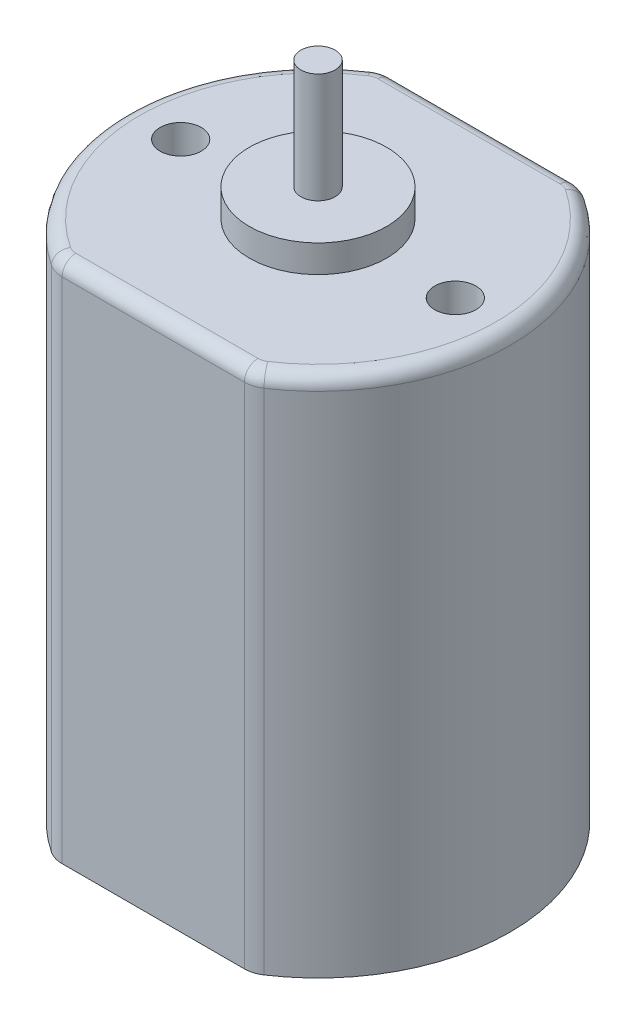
SolidWorks part; units mm, degrees
ref_plane "Face" through (0, 0, 0) normal (0, 0, 1) x (1, 0, 0)
ref_plane "Dessus" through (0, 0, 0) normal (0, 1, 0) x (1, 0, 0)
ref_plane "Droite" through (0, 0, 0) normal (1, 0, 0) x (0, 0, -1)
sketch "Esquisse1" plane through (0, 0, 0) normal (0, 1, 0) x (1, 0, 0)
  line L0 (-3.3166, -6) -> (3.3166, -6)
  line L1 (10.1485, 0) -> (-10.128, 0) construction
  line L2 (-3.3166, 6) -> (3.3166, 6)
  arc A0 (3.8694, -5.8333) -> (3.8694, 5.8333) centre (0, 0) ccw
  arc A1 (-3.8694, 5.8333) -> (-3.8694, -5.8333) centre (0, 0) ccw
  arc A2 (-3.3166, 6) -> (-3.8694, 5.8333) centre (-3.3166, 5) ccw
  arc A3 (3.8694, 5.8333) -> (3.3166, 6) centre (3.3166, 5) ccw
  arc A4 (-3.3166, -6) -> (-3.8694, -5.8333) centre (-3.3166, -5) cw
  arc A5 (3.8694, -5.8333) -> (3.3166, -6) centre (3.3166, -5) cw
  point P10 (-3.6056, 6)
  point P13 (3.6056, 6)
  point P16 (-3.6056, -6)
  point P19 (3.6056, -6)
  dimension "D1" = 14
  dimension "D3" = 1
  dimension "D2" = 12
extrude "Extrusion1" add sketch "Esquisse1" along normal blind 19
fillet "Congé1" radius 0.5 8 edges at (3.6053, 19, 5.9574) (0, 19, 6) (-3.6053, 19, 5.9574) (-7, 19, 0) (-3.6053, 19, -5.9574) (0, 19, -6) (3.6053, 19, -5.9574) (7, 19, 0)
sketch "Esquisse2" plane through (0, 19, 0) normal (0, 1, 0) x (-1, 0, 0)
  circle A0 centre (0, 0) radius 2.5
  dimension "D1" = 5
extrude "Extrusion2" add sketch "Esquisse2" along normal blind 1
sketch "Esquisse3" plane through (0, 20, 0) normal (0, 1, 0) x (-1, 0, 0)
  circle A0 centre (0, 0) radius 0.625
  dimension "D1" = 1.25
extrude "Extrusion3" add sketch "Esquisse3" along normal blind 4
sketch "Esquisse4" plane through (0, 19, 0) normal (0, 1, 0) x (-1, 0, 0)
  circle A0 centre (-5, 0) radius 0.75 construction
  circle A1 centre (3.5355, -3.5355) radius 0.5 construction
  circle A2 centre (5, 0) radius 0.75 construction
  circle A3 centre (-5, 0) radius 0.75
  circle A4 centre (3.5355, -3.5355) radius 0.5
  circle A5 centre (5, 0) radius 0.75
extrude "Enlèv. mat.-Extru.1" cut sketch "Esquisse4" against normal blind 2
